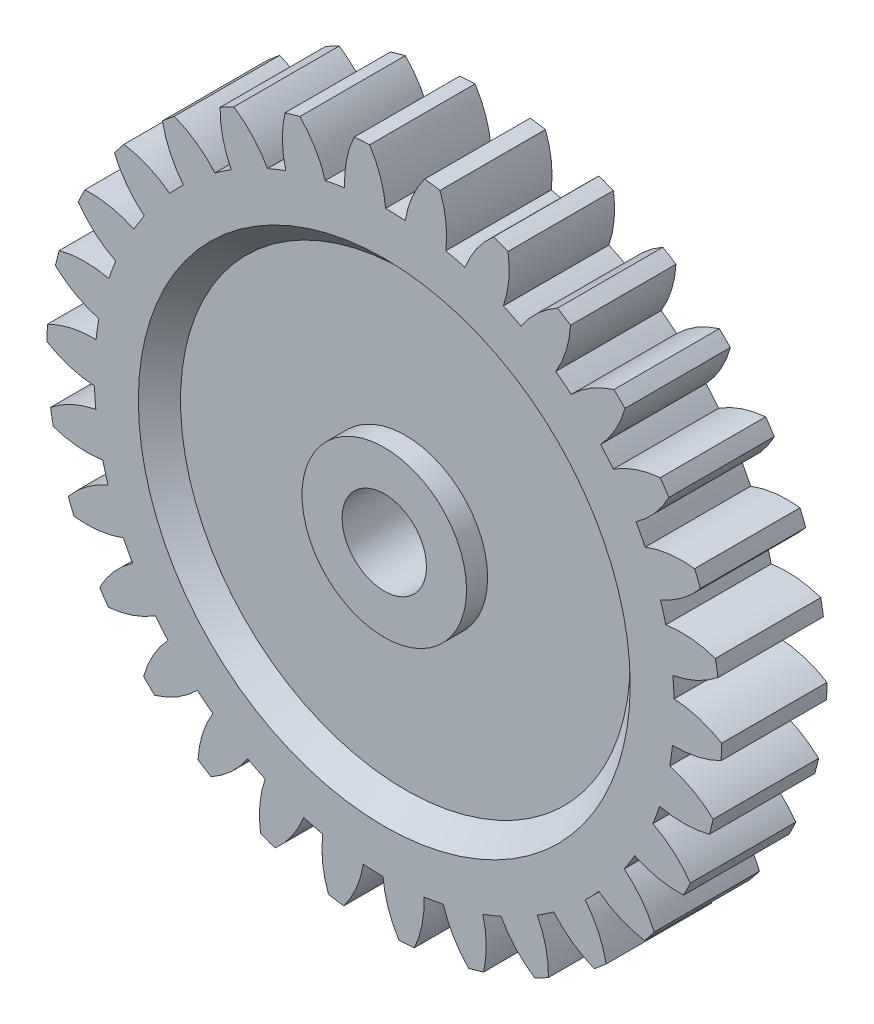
SolidWorks part; units mm, degrees
ref_plane "Front Plane" through (0, 0, 0) normal (0, 0, 1) x (1, 0, 0)
ref_plane "Top Plane" through (0, 0, 0) normal (0, 1, 0) x (1, 0, 0)
ref_plane "Right Plane" through (0, 0, 0) normal (1, 0, 0) x (0, 0, -1)
sketch "Root Circle" plane through (0, 0, 0) normal (0, 0, 1) x (1, 0, 0)
  circle A0 centre (0, 0) radius 13.75
extrude "Root Circle Thickness" add sketch "Root Circle" along normal blind 5
sketch "Sketch3" plane through (0, 0, 5) normal (0, 0, 1) x (1, 0, 0)
  line L0 (0, 0) -> (13.75, 0) construction
  line L1 (13.75, 0) -> (16.1667, 0) construction
  line L2 (0, 0) -> (13.2453, 4.8209) construction
  line L3 (13.2453, 4.8209) -> (15, 0) construction
  line L4 (15.5318, 0) -> (12.7918, -5.9202) construction
  line L5 (14.9985, 0.2098) -> (14.989, -0.5755) construction
  line L6 (0, 0) -> (14.989, -0.5755) construction
  circle A0 centre (0, 0) radius 14.0954 construction
  circle A1 centre (0, 0) radius 15 construction
  arc A2 (15.9699, -0.9803) -> (15.9981, -0.2472) centre (0, 0) ccw
  circle A3 centre (0, 0) radius 13.75 construction
  arc A4 (15.9981, -0.2472) -> (13.7428, 0.4452) centre (13.4768, -4.4402) ccw
  arc A5 (13.6682, -1.4977) -> (13.7428, 0.4452) centre (0, 0) ccw
  arc A6 (15.9699, -0.9803) -> (13.6682, -1.4977) centre (13.7776, 3.3937) cw
  point P10 (15.5318, 0)
  point P15 (13.4768, -4.4402)
  dimension "D1" = 6.5235
  dimension "D2" = 1.6309
extrude "Extrude3" add sketch "Sketch3" against normal blind 5
pattern_circular "CirPattern1" count 30 over 360 about axis through (0, 0, 0) along (0, 0, 1) of "Extrude3"
sketch "Sketch4" plane through (0, 0, 5) normal (0, 0, 1) x (1, 0, 0)
  circle A0 centre (0, 0) radius 2
  dimension "D1" = 4
extrude "Extrude4" cut sketch "Sketch4" against normal blind 13
sketch "Sketch5" plane through (0, 0, 5) normal (0, 0, 1) x (1, 0, 0)
  circle A0 centre (0, 0) radius 3.9011
  circle A1 centre (0, 0) radius 10.6633
extrude "Extrude5" cut sketch "Sketch5" against normal blind 1
chamfer "Chamfer1" distance 1 angle 45 1 edges at (10.6633, 0, 5)
ref_plane "Plane1" through (0, 0, 2.5) normal (0, 0, 1) x (1, 0, 0)
mirror "Mirror6" about plane through (0, 0, 2.5) normal (0, 0, 1) of "Extrude5"
chamfer "Chamfer2" distance 1 angle 45 1 edges at (10.6633, 0, 0)
equation "\"m\"=1"
equation "\"t\"=30"
equation "\"phi\"=20 ' Pressure Angle"
equation "\"a\"=\"m\" ' Addendum"
equation "\"d\"=1.25*\"a\" ' Dedendum"
equation "\"PCD\"=\"m\"*\"t\" ' Pitch Circle Diameter"
equation "\"TCD\"=\"PCD\"+(2*\"a\") ' Tip Circle Diameter"
equation "\"BCD\"=\"PCD\"* cos( \"phi\")  ' Base Circle Diameter"
equation "\"RCD\"=\"PCD\"-(2*\"d\") ' Root Circle Diameter"
equation "\"P\"= pi *\"m\" ' Circular Pitch"
equation "\"PA\"=360/\"t\" ' Pitch Angle"
equation "\"CTT\"=(pi*\"m\")/4"
equation "\"FR\"=0.3/\"P\" ' Fillet Radius"
equation "\"PC\"=(\"TCD\"-\"BCD\")/6 ' Point C Distance"
equation "\"DpD\"= \"D1@Sketch3\""
equation "\"D2@Sketch3\" = \"DpD\"/4"
